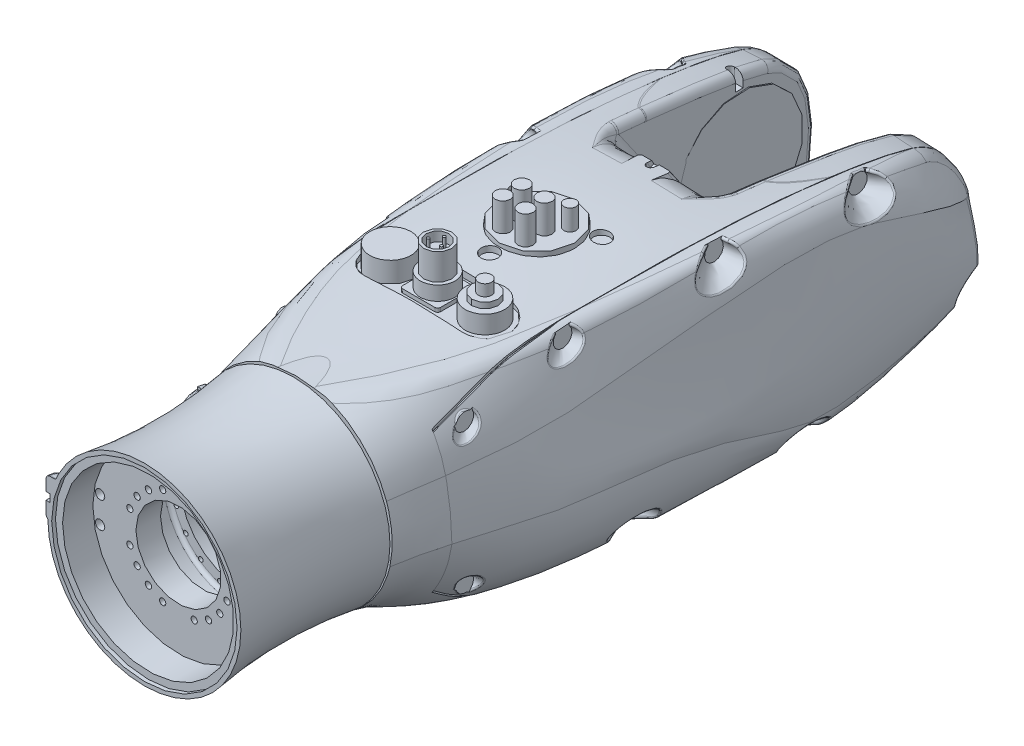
SolidWorks part; units mm, degrees
ref_plane "Front" through (0, 0, 0) normal (0, 0, 1) x (1, 0, 0)
ref_plane "Top" through (0, 0, 0) normal (0, 1, 0) x (1, 0, 0)
ref_plane "Right" through (0, 0, 0) normal (1, 0, 0) x (0, 0, -1)
imported_body "CR82391300-LSM-00-1-surface1"
imported_body "CR82391501-1-surface1"
imported_body "CR82391501-1-surface2"
sketch "Schizzo3" plane through (0, 238.0223, 0) normal (0, 1, 0) x (1, 0, 0)
  circle A0 centre (88.4136, -322.8337) radius 10.912
  circle A1 centre (113.4136, -322.8337) radius 9.2383
  circle A2 centre (138.4136, -322.8337) radius 10.4335
extrude "Estrusione-Estrusione1" add sketch "Schizzo3" along normal blind 27
sketch "Schizzo5" plane through (0, 265.0223, 0) normal (0, 1, 0) x (1, 0, 0)
  circle A0 centre (110.2163, -321.8869) radius 41.2538
extrude "Taglio-Estrusione3" cut sketch "Schizzo5" against normal blind 15
sketch "Schizzo6" plane through (0, 253.0223, 0) normal (0, 1, 0) x (1, 0, 0)
  circle A0 centre (138.4136, -322.8337) radius 3.4768
extrude "Estrusione-Estrusione2" add sketch "Schizzo6" along normal blind 6 separate body
